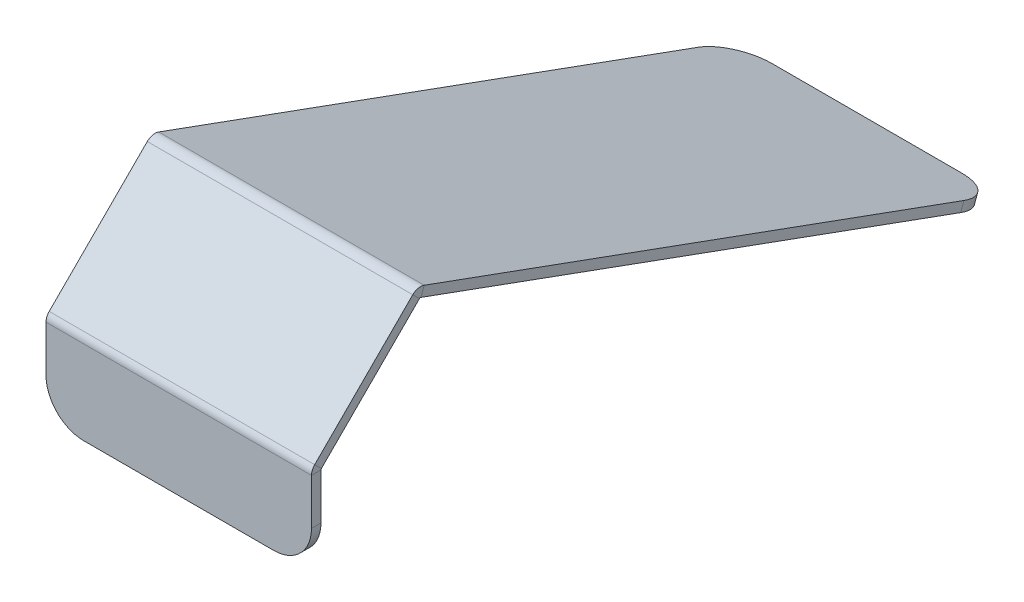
SolidWorks part; units mm, degrees
ref_plane "Plan de face" through (0, 0, 0) normal (0, 0, 1) x (1, 0, 0)
ref_plane "Plan de dessus" through (0, 0, 0) normal (0, 1, 0) x (1, 0, 0)
ref_plane "Plan de droite" through (0, 0, 0) normal (1, 0, 0) x (0, 0, -1)
sketch "Esquisse2" plane through (0, 0, 0) normal (0, 0, 1) x (1, 0, 0)
  line L1 (-70, 446.5) -> (70, 446.5)
  line L2 (-70, 446.5) -> (-70, 0)
  line L3 (-70, 0) -> (70, 0)
  line L4 (70, 446.5) -> (70, 0)
  dimension "D1" = 446.5
  dimension "D2" = 140
  dimension "D3" = 70
sheet metal parameters "Tôlerie 1" thickness 5 parameters "D1"=0.7366, "Epaisseur"=5
base flange "Tôle de base pliée1" sketch "Esquisse2" thickness 5 reverse thickness direction yes parameters "D1"=0.7366
sketch "Esquisse4" plane through (0, 0, 0) normal (0, 0, -1) x (-1, 0, 0)
  line L0 (-70, 45.5) -> (70, 45.5)
  line L1 (-70, 0) -> (-70, 446.5) construction
  line L2 (70, 446.5) -> (70, 0) construction
  line L3 (70, 0) -> (-70, 0) construction
  dimension "D1" = 45.5
sketched bend "Pli esquissé1" parameters "D1"=0.7366
bend "Pli esquissé2" bend radius 0.7366 bend angle 45 parameters "D5"=1
sketch "Esquisse5" plane through (0, 22.267, 22.267) normal (0, -0.7071, -0.7071) x (1, 0, 0)
  line L0 (-70, -106.7955) -> (70, -106.7955)
  line L1 (-70, -431.5245) -> (-70, -31.7955) construction
  line L2 (70, -31.7955) -> (70, -431.5245) construction
  line L3 (70, -31.7955) -> (-70, -31.7955) construction
  dimension "D1" = 75
sketched bend "Pli esquissé3" parameters "D1"=0.7366
bend "Pli esquissé4" bend radius 0.7366 bend angle 65 parameters "D5"=2
fillet "Congé1" radius 20 4 edges at (70, -11.4307, -356.9987) (-70, -11.4307, -356.9987) (70, 0, 2.5) (-70, 0, 2.5)
flat pattern "Etat déplié1"
sketch "Lignes de pliage1" plane through (0, 106.9928, -38.9422) normal (0, 0.9397, -0.342) x (-1, 0, 0)
  line L0 (70, -14.6496) -> (-70, -14.6496) construction
  line L1 (-70, 61.6215) -> (70, 61.6215) construction
  line L2 (70, -14.6496) -> (-70, -14.6496) construction
  line L3 (-70, 61.6215) -> (70, 61.6215) construction
bend of the flat pattern "Dépliage-<Pli esquissé2>1"
bend of the flat pattern "Dépliage-<Pli esquissé4>1"
